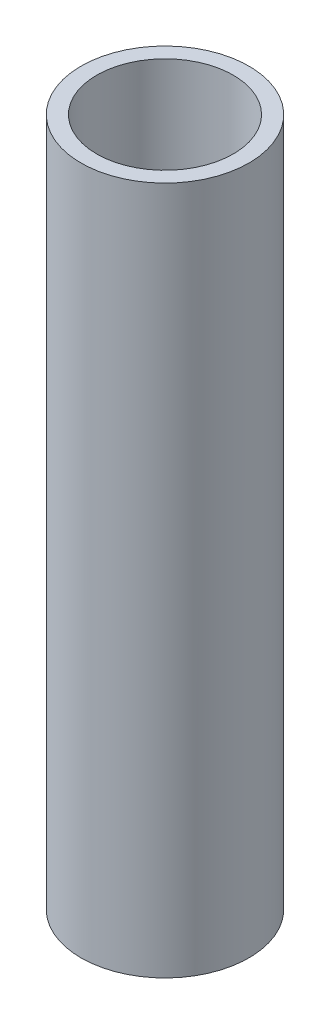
SolidWorks part; units mm, degrees
ref_plane "Front Plane" through (0, 0, 0) normal (0, 0, 1) x (1, 0, 0)
ref_plane "Top Plane" through (0, 0, 0) normal (0, 1, 0) x (1, 0, 0)
ref_plane "Right Plane" through (0, 0, 0) normal (1, 0, 0) x (0, 0, -1)
sketch "Sketch1" plane through (0, 0, 0) normal (0, 1, 0) x (1, 0, 0)
  circle A0 centre (0, 0) radius 4.7625
  circle A1 centre (0, 0) radius 3.8735
  dimension "D1" = 0.889
  dimension "D2" = 9.525
extrude "Boss-Extrude1" add sketch "Sketch1" along normal up to surface (39.0422 mm away)
